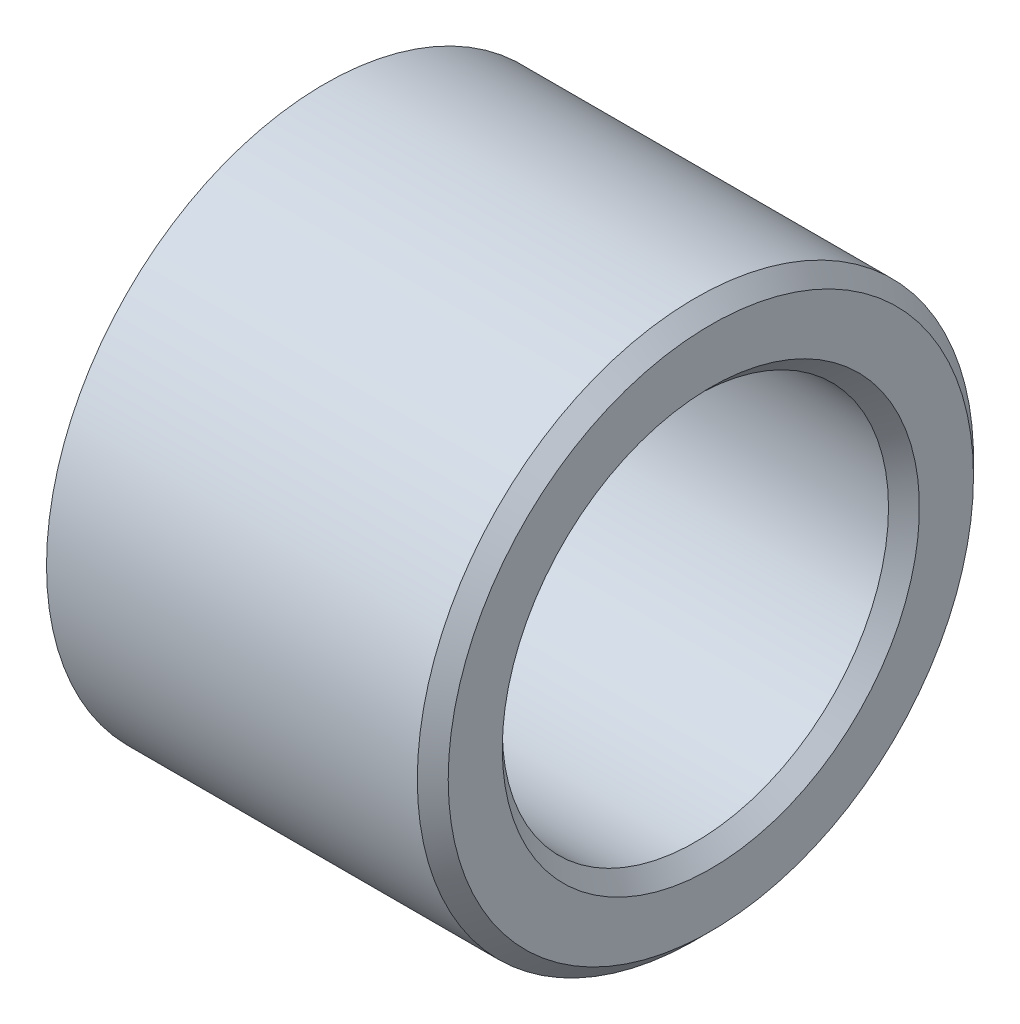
SolidWorks part; units mm, degrees
ref_plane "Plan1" through (0, 0, 0) normal (0, 0, 1) x (1, 0, 0)
ref_plane "Plan2" through (0, 0, 0) normal (0, 1, 0) x (1, 0, 0)
ref_plane "Plan3" through (0, 0, 0) normal (1, 0, 0) x (0, 0, -1)
sketch "Esquisse1" plane through (0, 0, 0) normal (0, 0, 1) x (1, 0, 0)
  line L0 (0, 25) -> (0, 36)
  line L1 (0, 36) -> (50, 36)
  line L2 (0, 25) -> (50, 25)
  line L3 (-5.5437, 0) -> (57.654, 0) construction
  line L4 (50, 36) -> (50, 25)
  dimension "D1" = 50
  dimension "D2" = 36
  dimension "D3" = 25
revolve "Base-Révolution" add sketch "Esquisse1" angle 360 about L3
chamfer "Chanfrein1" distance 2 angle 45
